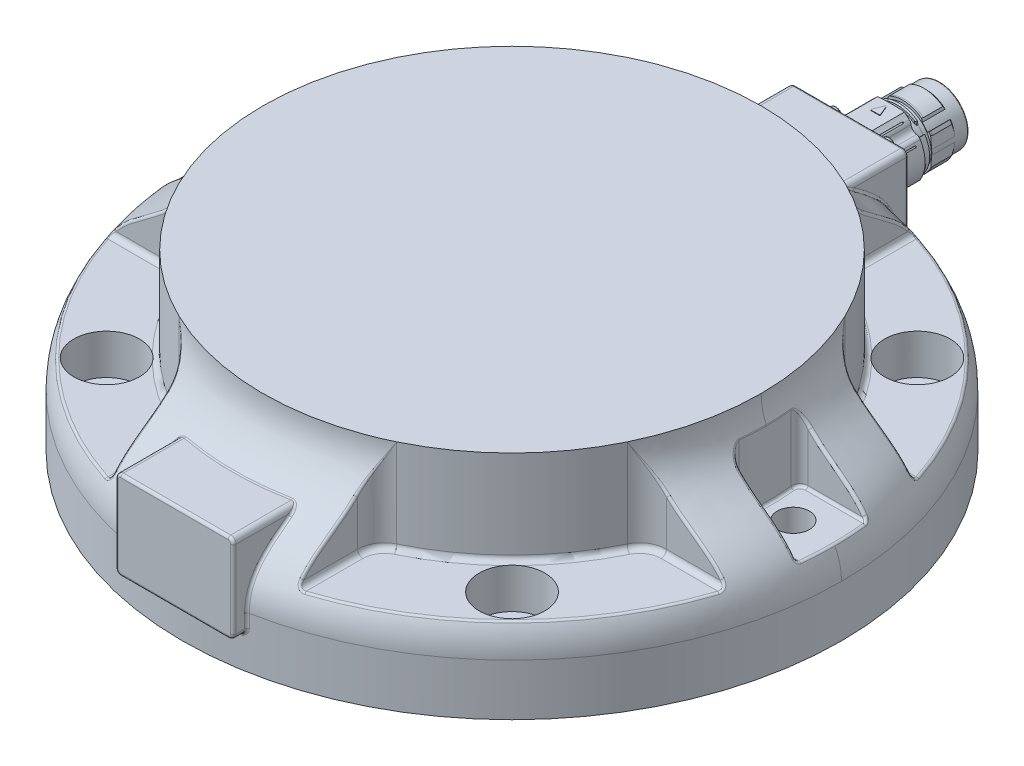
SolidWorks part; units mm, degrees
ref_plane "前视基准面" through (0, 0, 0) normal (0, 0, 1) x (1, 0, 0)
ref_plane "上视基准面" through (0, 0, 0) normal (0, 1, 0) x (1, 0, 0)
ref_plane "右视基准面" through (0, 0, 0) normal (1, 0, 0) x (0, 0, -1)
imported_body "输入2"
imported_body "输入3" [suppressed]
imported_body "输入4"
ref_plane "Plane1" through (-22, 14.25, -125) normal (0, 1, 0) x (1, 0, 0)
sketch "Sketch2" [suppressed] plane through (-21, 0, 0) normal (-1, 0, 0) x (0, 0, 1)
  line L0 (-121.8483, 14.25) -> (-125, 14.25) construction
  line L1 (-121.8483, 19.25) -> (-121.8483, 14.25) construction
  line L2 (-109.613, 31) -> (-117.4153, 31) construction
  line L3 (-108.591, 40.1008) -> (-108.591, 32) construction
  line L4 (-125, 43.25) -> (-105.7005, 43.25) construction
  line L5 (-121.8483, 14.25) -> (-125, 14.25)
  line L6 (-121.8483, 19.25) -> (-121.8483, 14.25)
  line L7 (-109.613, 31) -> (-117.4153, 31)
  line L8 (-108.591, 40.1008) -> (-108.591, 32)
  line L9 (-125, 43.25) -> (-105.7005, 43.25)
  line L10 (-125, 14.25) -> (-125, 43.25) construction
  line L11 (-125, 14.25) -> (-125, 43.25)
  circle A0 centre (-117, 36.25) radius 5.25
  spline S0 degree 3 poles (1848.4873, -312.6638) (478.1495, 12.7048) (-99.7372, 113.2273) (-121.3194, 24.3406) (-121.4142, 23.8865) (-121.5756, 22.9687) (-121.6422, 22.5053) (-129.6429, -48.2905) (183.381, -142.7899) (-2116.4995, -37.9882) knots -0.266422 -0.266422 -0.266422 -0.266422 0.005526 0.005526 0.006907 0.006907 0.008289 0.008289 0.218003 0.218003 0.218003 0.218003 weights 1 1 1 1 1 1 1 1 1 1 only from (-119.2101, 29.9466) to (-121.8483, 19.25) construction
  spline S1 degree 3 poles (-1486.0701, -1421.419) (-44.0402, -127.6618) (-103.012, 34.9608) (-118.1304, 30.8813) (-118.3016, 30.8098) (-118.6143, 30.6269) (-118.7599, 30.5135) (-132.2685, 16.6638) (65.4209, -164.9287) (1474.2496, -1177.9513) knots -0.045856 -0.045856 -0.045856 -0.045856 0.000543 0.000543 0.001086 0.001086 0.001629 0.001629 0.058823 0.058823 0.058823 0.058823 weights 1 1 1 1 1 1 1 1 1 1 only from (-117.4153, 31) to (-119.2101, 29.9466) construction
  spline S2 degree 3 poles (-776.1144, -1852.1668) (-181.709, 79.7987) (-105.7336, 38.4744) (-108.6963, 31.5529) (-108.7282, 31.4953) (-108.8033, 31.3864) (-108.8467, 31.3352) (-108.9887, 31.1977) (-109.1025, 31.1241) (-115.9111, 28.3871) (-156.6473, 95.2196) (1783.3337, 673.7137) knots -0.021872 -0.021872 -0.021872 -0.021872 0.000395 0.000395 0.000592 0.000592 0.00079 0.00079 0.001185 0.001185 0.022796 0.022796 0.022796 0.022796 weights 1 1 1 1 1 1 1 1 1 1 1 1 only from (-108.591, 32) to (-109.613, 31) construction
  spline S3 degree 3 poles (-1142.0637, -1668.0059) (3.6009, 15.1703) (-102.9695, 51.7063) (-108.4484, 40.85) (-108.5021, 40.7036) (-112.7877, 22.7326) (132.936, -38.0757) (1866.1968, -274.2772) knots -0.035074 -0.035074 -0.035074 -0.035074 0.000914 0.000914 0.001371 0.001371 0.056223 0.056223 0.056223 0.056223 weights 1 1 1 1 1 1 1 1 only from (-107.7941, 41.6851) to (-108.591, 40.1008) construction
  spline S4 degree 3 poles (-1159.1108, 1740.2878) (1131.6394, -1516.8224) (-1343.8665, 1602.8051) (947.0729, -1654.5576) knots -0.172236 -0.172236 -0.172236 -0.172236 0.173207 0.173207 0.173207 0.173207 weights 1 1 1 1 only from (-105.7005, 43.25) to (-107.7941, 41.6851) construction
  spline S5 degree 3 poles (-119.2101, 29.9466) (-120.1079, 28.3059) (-120.7739, 26.5869) (-121.3194, 24.3406) (-121.4142, 23.8865) (-121.5756, 22.9687) (-121.6422, 22.5053) (-121.7993, 21.1153) (-121.8483, 20.1845) (-121.8483, 19.25) knots 0 0 0 0 0.005526 0.005526 0.006907 0.006907 0.008289 0.008289 0.011052 0.011052 0.011052 0.011052 weights 1 1 1 1 1 1 1 1 1 1
  spline S6 degree 3 poles (-117.4153, 31) (-117.5997, 31) (-117.7806, 30.9756) (-118.1304, 30.8813) (-118.3016, 30.8098) (-118.6143, 30.6269) (-118.7599, 30.5135) (-119.0139, 30.253) (-119.1219, 30.1077) (-119.2101, 29.9466) knots 0 0 0 0 0.000543 0.000543 0.001086 0.001086 0.001629 0.001629 0.002172 0.002172 0.002172 0.002172 weights 1 1 1 1 1 1 1 1 1 1
  spline S7 degree 3 poles (-108.591, 32) (-108.591, 31.8679) (-108.6182, 31.7354) (-108.6963, 31.5529) (-108.7282, 31.4953) (-108.8033, 31.3864) (-108.8467, 31.3352) (-108.9887, 31.1977) (-109.1025, 31.1241) (-109.3468, 31.0259) (-109.4803, 31) (-109.613, 31) knots 0 0 0 0 0.000395 0.000395 0.000592 0.000592 0.00079 0.00079 0.001185 0.001185 0.001579 0.001579 0.001579 0.001579 weights 1 1 1 1 1 1 1 1 1 1 1 1
  spline S8 degree 3 poles (-107.7941, 41.6851) (-108.0398, 41.5) (-108.2424, 41.2583) (-108.4484, 40.85) (-108.5021, 40.7036) (-108.5729, 40.4067) (-108.591, 40.2553) (-108.591, 40.1008) knots 0 0 0 0 0.000914 0.000914 0.001371 0.001371 0.001828 0.001828 0.001828 0.001828 weights 1 1 1 1 1 1 1 1
  spline S9 degree 3 poles (-105.7005, 43.25) (-106.399, 42.7292) (-107.0982, 42.2094) (-107.7941, 41.6851) knots 0 0 0 0 0.002614 0.002614 0.002614 0.002614 weights 1 1 1 1
sketch "Sketch3" plane through (-22, 0, 0) normal (-1, 0, 0) x (0, 0, 1)
  line L6 (-117.4153, 31) -> (-109.613, 31)
  line L7 (-108.591, 32) -> (-108.591, 40.1008)
  line L8 (-105.7005, 43.25) -> (-125, 43.25)
  line L9 (-125, 43.25) -> (-125, 14.25)
  line L10 (-125, 14.25) -> (-121.8483, 14.25)
  line L11 (-121.8483, 14.25) -> (-121.8483, 19.25)
  line L12 (-117.4153, 31) -> (-109.613, 31)
  line L13 (-108.591, 32) -> (-108.591, 40.1008)
  line L14 (-105.7005, 43.25) -> (-125, 43.25)
  line L15 (-125, 43.25) -> (-125, 14.25)
  line L16 (-125, 14.25) -> (-121.8483, 14.25)
  line L17 (-121.8483, 14.25) -> (-121.8483, 19.25)
  spline S5 degree 3 poles (2287.8256, -1759.3828) (137.4844, -230.3961) (-134.5075, 14.3683) (-118.7599, 30.5135) (-118.6143, 30.6269) (-118.3016, 30.8098) (-118.1304, 30.8813) (-100.7791, 35.5633) (-25.4339, -179.9812) (-2238.172, -2080.345) knots -0.066221 -0.066221 -0.066221 -0.066221 0.000543 0.000543 0.001086 0.001086 0.001629 0.001629 0.054961 0.054961 0.054961 0.054961 weights 1 1 1 1 1 1 1 1 1 1 only from (-119.2101, 29.9466) to (-117.4153, 31)
  spline S6 degree 3 poles (2743.0192, 954.5784) (-168.9946, 115.7559) (-116.8673, 28.0028) (-109.1025, 31.1241) (-108.9887, 31.1977) (-108.8467, 31.3352) (-108.8033, 31.3864) (-108.7282, 31.4953) (-108.6963, 31.5529) (-105.313, 39.4569) (-205.0896, 92.3423) (-1064.6945, -2809.5632) knots -0.024307 -0.024307 -0.024307 -0.024307 0.000395 0.000395 0.00079 0.00079 0.000987 0.000987 0.001185 0.001185 0.026641 0.026641 0.026641 0.026641 weights 1 1 1 1 1 1 1 1 1 1 1 1 only from (-109.613, 31) to (-108.591, 32)
  spline S7 degree 3 poles (2857.2962, -406.9187) (221.3456, -59.4346) (-113.4928, 19.7759) (-108.5021, 40.7036) (-108.4484, 40.85) (-102.2003, 53.2306) (35.9527, 3.8248) (-1710.6129, -2490.4704) knots -0.063495 -0.063495 -0.063495 -0.063495 0.000457 0.000457 0.000914 0.000914 0.042019 0.042019 0.042019 0.042019 weights 1 1 1 1 1 1 1 1 only from (-108.591, 40.1008) to (-107.7941, 41.6851)
  spline S8 degree 3 poles (1525.4828, -2470.325) (-1949.0933, 2398.5609) (1736.853, -2312.5604) (-1737.4808, 2556.0021) knots -0.195689 -0.195689 -0.195689 -0.195689 0.199945 0.199945 0.199945 0.199945 weights 1 1 1 1 only from (-107.7941, 41.6851) to (-105.7005, 43.25)
  spline S9 degree 3 poles (-3115.2286, 11.5164) (267.2849, -166.9671) (-130.6435, -57.145) (-121.6422, 22.5053) (-121.5756, 22.9687) (-121.4142, 23.8865) (-121.3194, 24.3406) (-95.2218, 131.8242) (745.7927, -37.9272) (2820.2813, -548.0829) knots -0.233354 -0.233354 -0.233354 -0.233354 0.002763 0.002763 0.004144 0.004144 0.005526 0.005526 0.33466 0.33466 0.33466 0.33466 weights 1 1 1 1 1 1 1 1 1 1 only from (-121.8483, 19.25) to (-119.2101, 29.9466)
  spline S10 degree 3 poles (-119.2101, 29.9466) (-119.1219, 30.1077) (-119.0139, 30.253) (-118.7599, 30.5135) (-118.6143, 30.6269) (-118.3016, 30.8098) (-118.1304, 30.8813) (-117.7806, 30.9756) (-117.5997, 31) (-117.4153, 31) knots 0 0 0 0 0.000543 0.000543 0.001086 0.001086 0.001629 0.001629 0.002172 0.002172 0.002172 0.002172 weights 1 1 1 1 1 1 1 1 1 1
  spline S11 degree 3 poles (-109.613, 31) (-109.4803, 31) (-109.3468, 31.0259) (-109.1025, 31.1241) (-108.9887, 31.1977) (-108.8467, 31.3352) (-108.8033, 31.3864) (-108.7282, 31.4953) (-108.6963, 31.5529) (-108.6182, 31.7354) (-108.591, 31.8679) (-108.591, 32) knots 0 0 0 0 0.000395 0.000395 0.00079 0.00079 0.000987 0.000987 0.001185 0.001185 0.001579 0.001579 0.001579 0.001579 weights 1 1 1 1 1 1 1 1 1 1 1 1
  spline S12 degree 3 poles (-108.591, 40.1008) (-108.591, 40.2553) (-108.5729, 40.4067) (-108.5021, 40.7036) (-108.4484, 40.85) (-108.2424, 41.2583) (-108.0398, 41.5) (-107.7941, 41.6851) knots 0 0 0 0 0.000457 0.000457 0.000914 0.000914 0.001828 0.001828 0.001828 0.001828 weights 1 1 1 1 1 1 1 1
  spline S13 degree 3 poles (-107.7941, 41.6851) (-107.0982, 42.2094) (-106.399, 42.7292) (-105.7005, 43.25) knots 0 0 0 0 0.002614 0.002614 0.002614 0.002614 weights 1 1 1 1
  spline S14 degree 3 poles (-121.8483, 19.25) (-121.8483, 20.1845) (-121.7993, 21.1153) (-121.6422, 22.5053) (-121.5756, 22.9687) (-121.4142, 23.8865) (-121.3194, 24.3406) (-120.7739, 26.5869) (-120.1079, 28.3059) (-119.2101, 29.9466) knots 0 0 0 0 0.002763 0.002763 0.004144 0.004144 0.005526 0.005526 0.011052 0.011052 0.011052 0.011052 weights 1 1 1 1 1 1 1 1 1 1
  dimension "D1" = 0
extrude "Extrude1" add sketch "Sketch3" against normal up to surface (1 mm away)
sketch "Sketch4" plane through (-22, 0, 0) normal (-1, 0, 0) x (0, 0, 1)
  line L0 (-109.613, 31) -> (-117.4153, 31) construction
  line L1 (-108.591, 40.1008) -> (-108.591, 32) construction
  circle A0 centre (-117.001, 36.25) radius 5.25
  dimension "D1" = 10.5
  dimension "D2" = 8.41
extrude "Extrude2" cut sketch "Sketch4" against normal blind 1
sketch "Sketch5" plane through (0, 0, -128.5) normal (0, 0, -1) x (-1, 0, 0)
  circle A0 centre (-9.9, 38.65) radius 2.25
  dimension "D1" = 4.5
extrude "Extrude3" add sketch "Sketch5" along normal blind 2.5
sketch "Sketch6" plane through (0, 0, -131) normal (0, 0, -1) x (-1, 0, 0)
  line L1 (-8.7453, 38.65) -> (-9.3226, 39.65)
  line L2 (-9.3226, 39.65) -> (-10.4774, 39.65)
  line L3 (-10.4774, 39.65) -> (-11.0547, 38.65)
  line L4 (-11.0547, 38.65) -> (-10.4774, 37.65)
  line L5 (-10.4774, 37.65) -> (-9.3226, 37.65)
  line L6 (-9.3226, 37.65) -> (-8.7453, 38.65)
  circle A0 centre (-9.9, 38.65) radius 1 construction
  dimension "D1" = 2
extrude "Extrude4" cut sketch "Sketch6" against normal blind 1.1
fillet "Fillet1" radius 0.5 1 edges at (9.9, 40.9, -131)
pattern_linear "LPattern1" count 2 spacing 19.8 along (-1, 0, 0) count 2 spacing 19.8 along (0, -1, 0) of "Extrude3", "Extrude4", "Fillet1"
